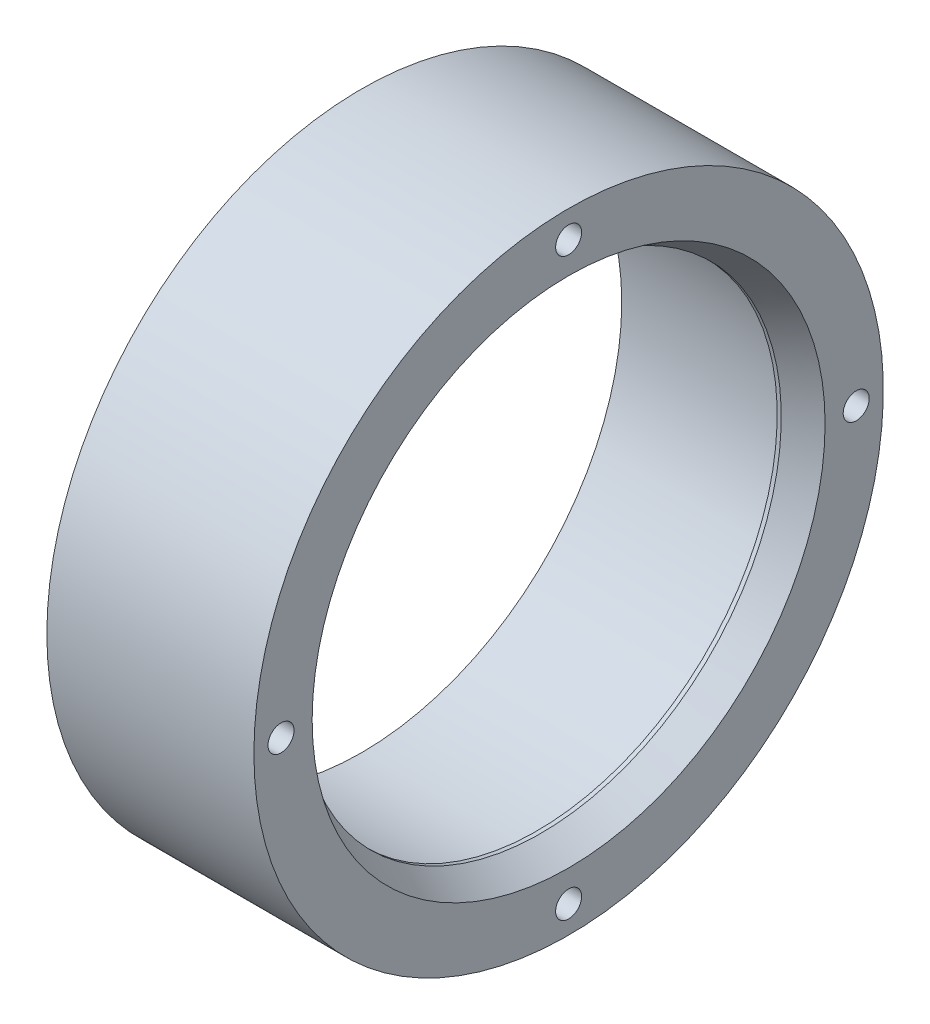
SolidWorks part; units mm, degrees
ref_plane "front" through (0, 0, 0) normal (0, 0, 1) x (1, 0, 0)
ref_plane "top" through (0, 0, 0) normal (0, 1, 0) x (1, 0, 0)
ref_plane "right" through (0, 0, 0) normal (1, 0, 0) x (0, 0, -1)
sketch "Sketch1" plane through (0, 0, 0) normal (0, 0, 1) x (1, 0, 0)
  line L0 (-62.3058, 0) -> (65.146, 0) construction
  line L1 (25.4, 51.8668) -> (25.4, 62.738)
  line L2 (25.4, 62.738) -> (66.675, 62.738)
  line L3 (66.675, 51.1267) -> (66.675, 62.738)
  line L4 (60.325, 51.1048) -> (60.325, 47.9298)
  line L5 (59.563, 51.8668) -> (25.4, 51.8668)
  line L6 (60.325, 47.9298) -> (61.1378, 47.9298)
  line L7 (61.1378, 47.9298) -> (66.675, 51.1267)
  arc A0 (60.325, 51.1048) -> (59.563, 51.8668) centre (59.563, 51.1048) ccw
  dimension "D1" = 0.8128
  dimension "D3" = 0.762
  dimension "D2" = 47.9298
  dimension "D4" = 62.738
  dimension "D5" = 30
  dimension "D6" = 34.925
  dimension "D7" = 41.275
  dimension "D8" = 51.8668
  dimension "D9" = 25.4
revolve "Base-Revolve" add sketch "Sketch1" angle 360 about L0
ref_plane "Plane1" through (25.4, 0, 0) normal (1, 0, 0) x (0, 0, -1)
sketch "Sketch2" plane through (25.4, 0, 0) normal (1, 0, 0) x (0, 0, -1)
  line L0 (96.2179, 0) -> (-86.6803, 0) construction
  line L1 (0, 67.4647) -> (0, -64.9401) construction
  circle A0 centre (0, -57.3278) radius 3.3782
  dimension "D1" = 6.7564
  dimension "D2" = 57.3278
extrude "Cut-Extrude1" cut sketch "Sketch2" along normal blind 27.94
sketch "Sketch4" plane through (53.34, 0, 0) normal (-1, 0, 0) x (0, 0, 1)
  circle A0 centre (0, -57.3278) radius 2.5908
  dimension "D1" = 5.1816
extrude "Cut-Extrude2" cut sketch "Sketch4" against normal through all
pattern_circular "CirPattern3" count 4 every 90 about axis through (-62.3058, 0, 0) along (1, 0, 0)
